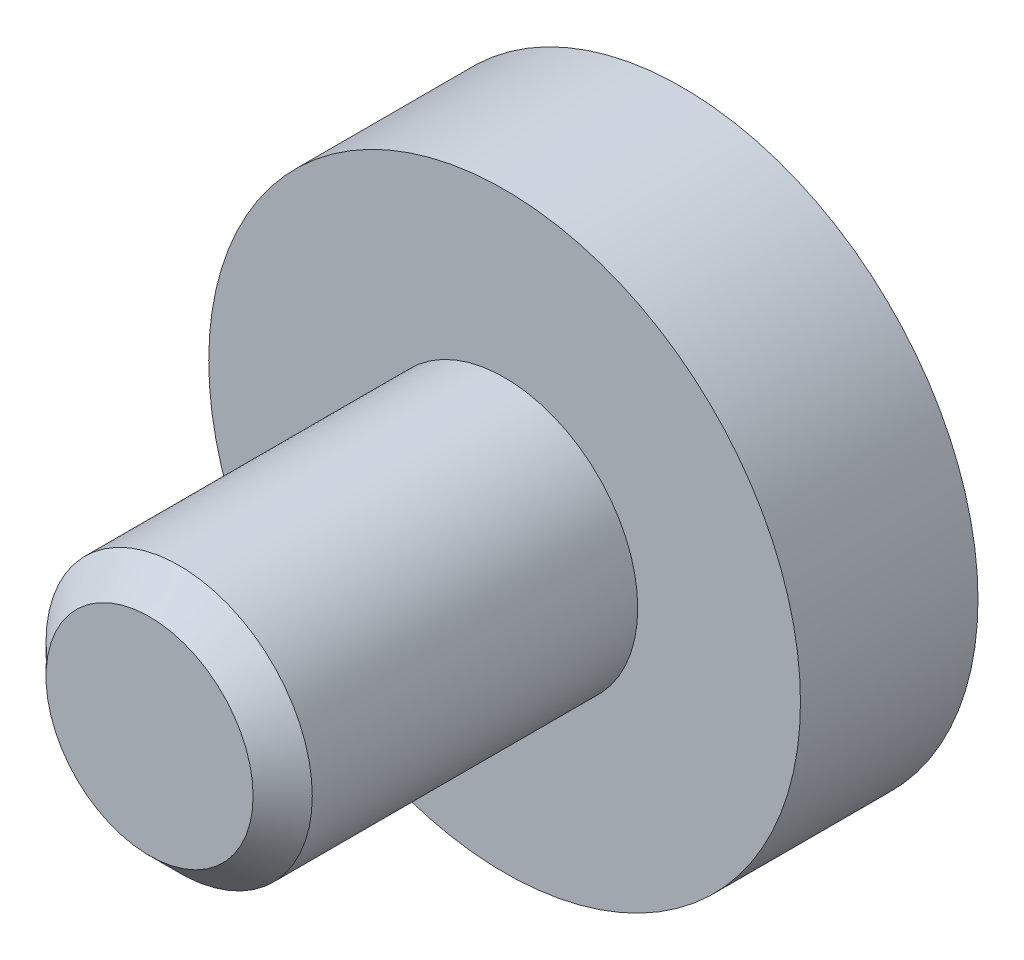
SolidWorks part; units mm, degrees
ref_plane "Plan de face" through (0, 0, 0) normal (0, 0, 1) x (1, 0, 0)
ref_plane "Plan de dessus" through (0, 0, 0) normal (0, 1, 0) x (1, 0, 0)
ref_plane "Plan de droite" through (0, 0, 0) normal (1, 0, 0) x (0, 0, -1)
sketch "Esquisse1" plane through (0, 0, 0) normal (0, 0, 1) x (1, 0, 0)
  circle A0 centre (0, 0) radius 5
  point P2 (0, 0)
  dimension "D1" = 10
extrude "Boss.-Extru.1" add sketch "Esquisse1" along normal blind 3
sketch "Esquisse2" plane through (0, 0, 3) normal (0, 0, 1) x (1, 0, 0)
  circle A0 centre (0, 0) radius 2.25
  dimension "D1" = 4.5
extrude "Boss.-Extru.2" add sketch "Esquisse2" along normal blind 6
chamfer "Chanfrein1" distance 0.5 angle 45 1 edges at (2.25, 0, 9)
